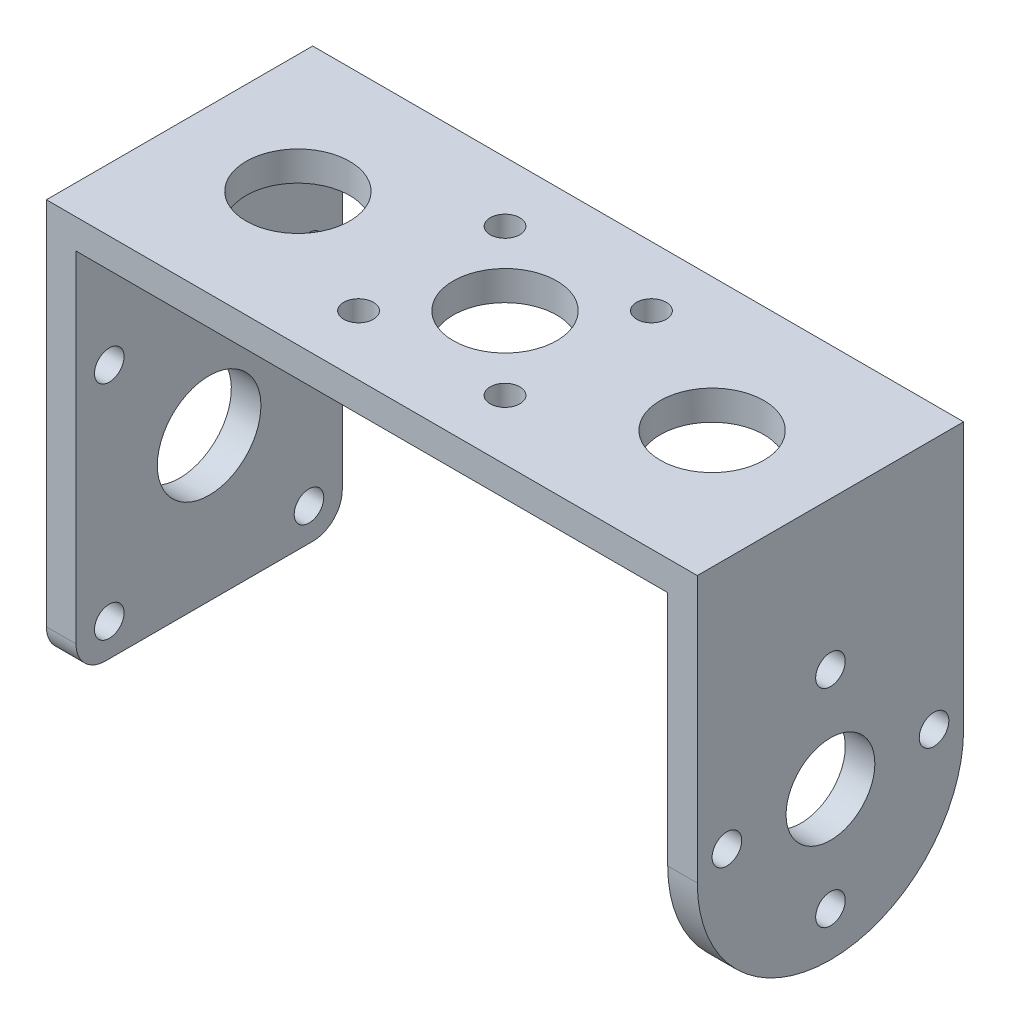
SolidWorks part; units mm, degrees
ref_plane "Front Plane" through (0, 0, 0) normal (0, 0, 1) x (1, 0, 0)
ref_plane "Top Plane" through (0, 0, 0) normal (0, 1, 0) x (1, 0, 0)
ref_plane "Right Plane" through (0, 0, 0) normal (1, 0, 0) x (0, 0, -1)
sketch "Sketch1" plane through (0, 0, 0) normal (0, 0, 1) x (1, 0, 0)
  line L0 (-22, -13.5) -> (-20, -13.5)
  line L1 (-22, 13.5) -> (22, 13.5)
  line L2 (-22, 13.5) -> (-22, -13.5)
  line L3 (-20, -13.5) -> (-20, 11.5)
  line L4 (22, 13.5) -> (22, -13.5)
  line L7 (-20, 11.5) -> (20, 11.5)
  line L8 (20, 11.5) -> (20, -13.5)
  line L9 (20, -13.5) -> (22, -13.5)
  point P0 (0, 0)
  dimension "D1" = 44
  dimension "D2" = 27
  dimension "D3" = 2
  dimension "D4" = 2
extrude "Boss-Extrude1" add sketch "Sketch1" along normal blind 18
fillet "Fillet1" radius 9 2 edges at (21, -13.5, 0) (21, -13.5, 18)
fillet "Fillet2" radius 2 2 edges at (-21, -13.5, 0) (-21, -13.5, 18)
sketch "Sketch2" plane through (22, 0, 0) normal (1, 0, 0) x (0, 0, -1)
  line L0 (-9, -13.5) -> (-9, 6.5) construction
  circle A0 centre (-9, -3.5) radius 3
  circle A1 centre (-9, -10.5) radius 1
  circle A2 centre (-16, -3.5) radius 1
  circle A3 centre (-9, 3.5) radius 1
  circle A4 centre (-2, -3.5) radius 1
  point P18 (-9, -3.5)
  dimension "D1" = 10
  dimension "D3" = 2
  dimension "D4" = 6
  dimension "D2" = 7
extrude "Cut-Extrude1" cut sketch "Sketch2" against normal up to next
sketch "Sketch3" plane through (-22, 0, 0) normal (-1, 0, 0) x (0, 0, 1)
  line L0 (9, -13.5) -> (9, 13.5) construction
  line L1 (16, -13.5) -> (2, -13.5) construction
  line L2 (18, 13.5) -> (0, 13.5) construction
  line L4 (2.25, 3.7) -> (15.75, 3.7)
  line L5 (2.25, 3.7) -> (2.25, -11.3)
  line L6 (2.25, -11.3) -> (15.75, -11.3)
  line L7 (15.75, 3.7) -> (15.75, -11.3)
  line L8 (2.25, 3.7) -> (15.75, -11.3) construction
  line L9 (2.25, -11.3) -> (15.75, 3.7) construction
  circle A0 centre (9, -3.8) radius 3.5
  circle A1 centre (15.75, 3.7) radius 1
  circle A2 centre (2.25, 3.7) radius 1
  circle A3 centre (2.25, -11.3) radius 1
  circle A4 centre (15.75, -11.3) radius 1
  dimension "D1" = 13.5
  dimension "D4" = 2
  dimension "D5" = 7
  dimension "D2" = 9.7
  dimension "D3" = 15
  dimension "D6" = 2
extrude "Cut-Extrude2" cut sketch "Sketch3" against normal up to next contours A0 | L4 A2 L5 | L5 A2 L4 | L7 A1 L4 | L4 A1 L7 | L6 A4 L7 | L7 A4 L6 | L6 A3 L5 | L5 A3 L6
sketch "Sketch4" plane through (0, 13.5, 0) normal (0, 1, 0) x (1, 0, 0)
  line L0 (0, 0) -> (0, -18) construction
  line L1 (22, -18) -> (-22, -18) construction
  line L3 (-4.9497, -4.0503) -> (4.9497, -4.0503)
  line L4 (-4.9497, -4.0503) -> (-4.9497, -13.9497)
  line L5 (-4.9497, -13.9497) -> (4.9497, -13.9497)
  line L6 (4.9497, -4.0503) -> (4.9497, -13.9497)
  line L7 (-4.9497, -4.0503) -> (4.9497, -13.9497) construction
  line L8 (-4.9497, -13.9497) -> (4.9497, -4.0503) construction
  circle A0 centre (0, -9) radius 3.5
  circle A1 centre (4.9497, -4.0503) radius 1
  circle A2 centre (4.9497, -13.9497) radius 1
  circle A3 centre (-4.9497, -13.9497) radius 1
  circle A4 centre (-4.9497, -4.0503) radius 1
  point P5 (0, -9)
  point P22 (0, -9)
  dimension "D1" = 7
  dimension "D3" = 2
  dimension "D2" = 7
extrude "Cut-Extrude3" cut sketch "Sketch4" against normal blind 20 contours L6 A1 L3 | L3 A1 L6 | A0 | L3 A4 L4 | L4 A4 L3 | L4 A3 L5 | L5 A3 L4 | L6 A2 L5 | L5 A2 L6
sketch "Sketch5" plane through (0, 13.5, 0) normal (0, 1, 0) x (1, 0, 0)
  line L0 (-22, -9) -> (22, -9) construction
  line L1 (-22, -18) -> (-22, 0) construction
  line L2 (22, -18) -> (22, 0) construction
  line L3 (0, 0) -> (0, -18) construction
  line L4 (22, 0) -> (-22, 0) construction
  line L5 (22, -18) -> (-22, -18) construction
  circle A0 centre (-14, -9) radius 3.5
  circle A1 centre (14, -9) radius 3.5
  dimension "D1" = 14
  dimension "D2" = 7
extrude "Cut-Extrude4" cut sketch "Sketch5" against normal up to next
